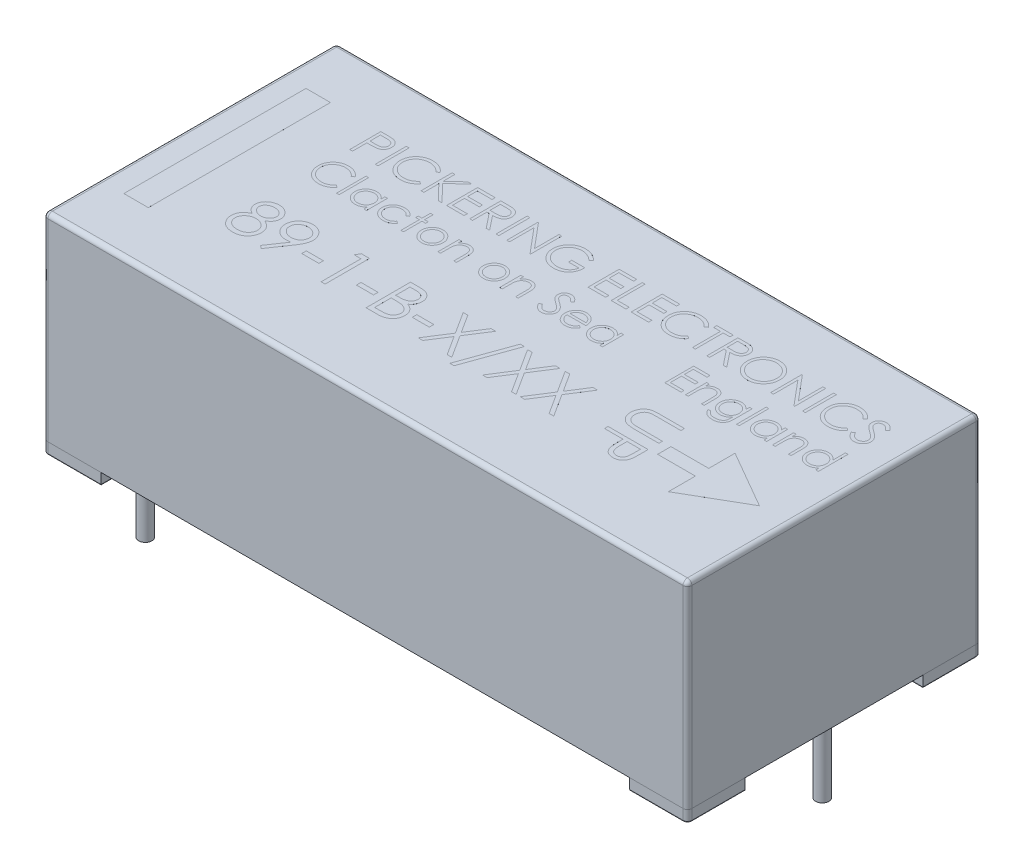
SolidWorks part; units mm, degrees
ref_plane "Front Plane" through (0, 0, 0) normal (0, 0, 1) x (1, 0, 0)
ref_plane "Top Plane" through (0, 0, 0) normal (0, 1, 0) x (1, 0, 0)
ref_plane "Right Plane" through (0, 0, 0) normal (1, 0, 0) x (0, 0, -1)
sketch "Sketch2" plane through (0, 0, 0) normal (0, 1, 0) x (1, 0, 0)
  line L1 (14.5, -6.6) -> (-14.5, -6.6)
  line L2 (14.5, -6.6) -> (14.5, 6.6)
  line L3 (14.5, 6.6) -> (-14.5, 6.6)
  line L4 (-14.5, -6.6) -> (-14.5, 6.6)
  line L5 (14.5, -6.6) -> (-14.5, 6.6) construction
  line L6 (14.5, 6.6) -> (-14.5, -6.6) construction
  point P0 (0, 0)
  dimension "D1" = 13.2
  dimension "D2" = 29
extrude "Main Body" add sketch "Sketch2" along normal blind 8.89 draft 0.023
sketch "Sketch9" plane through (0, 0, 0) normal (0, -1, 0) x (1, 0, 0)
  line L0 (-14.5, -6.6) -> (-14.5, 6.6) construction
  circle A0 centre (-12.7, -3.81) radius 0.3
  circle A2 centre (-12.7, -1.27) radius 0.3
  circle A3 centre (-12.7, 3.81) radius 0.3
  dimension "D1" = 0.6
  dimension "D5" = 0.6
  dimension "D7" = 0.6
  dimension "D2" = 2.54
  dimension "D3" = 1.8
  dimension "D4" = 5.08
extrude "Left hand Pins" add sketch "Sketch9" along normal blind 4.31
sketch "Sketch10" plane through (0, 0, 0) normal (0, -1, 0) x (1, 0, 0)
  line L1 (14.5, 6.6) -> (11.9, 6.6)
  line L2 (14.5, 6.6) -> (14.5, 4)
  line L3 (14.5, 4) -> (11.9, 4)
  line L4 (11.9, 6.6) -> (11.9, 4)
  dimension "D1" = 2.6
  dimension "D2" = 2.6
extrude "Foot" add sketch "Sketch10" along normal blind 0.51
sketch "Sketch11" plane through (0, -0.51, 0) normal (0, -1, 0) x (1, 0, 0)
  line L0 (14.5, 6.6) -> (11.9, 6.6) construction
  line L1 (11.9, 4) -> (13.95, 4)
  line L2 (11.9, 4) -> (11.9, 6.05)
  line L3 (11.9, 6.05) -> (13.95, 6.05)
  line L4 (13.95, 4) -> (13.95, 6.05)
  line L5 (14.5, 4) -> (14.5, 6.6) construction
  dimension "D1" = 0.55
  dimension "D2" = 0.55
extrude "foot cut" cut sketch "Sketch11" against normal up to surface (0.51 mm away)
mirror "Mirror3" about plane through (0, 0, 0) normal (0, 0, 1) of "foot cut", "Foot"
mirror "Mirror4" about plane through (0, 0, 0) normal (1, 0, 0) of "Mirror3", "Foot", "foot cut"
sketch "Sketch12"
  dimension "D1" = 1.1
  dimension "D2" = 8.2
  dimension "D3" = 2.4965
  dimension "D4" = 1.4
  dimension "D5" = 2
  dimension "D6" = 3.8
extrude "Lettering" add sketch "Sketch12" along normal blind 0.0001
sketch "Sketch13" plane through (0, 0, 0) normal (0, -1, 0) x (1, 0, 0)
  line L1 (11.9, -6.6) -> (-11.9, -6.6) construction
  line L3 (14.5, 4) -> (14.5, -4) construction
  circle A0 centre (12.7, -1.27) radius 0.3
  dimension "D1" = 0.6
  dimension "D2" = 5.33
  dimension "D5" = 1.8
extrude "Right hand pins" add sketch "Sketch13" along normal blind 4.31
fillet "Fillet1" radius 0.2 12 edges at (14.5, -0.255, -6.6) (14.5, -0.255, 6.6) (-14.5, -0.255, 6.6) (-14.5, -0.255, -6.6) (14.4983, 4.445, -6.5983) (0, 8.89, -6.5965) (14.4983, 4.445, 6.5983) (14.4965, 8.89, 0) (-14.4983, 4.445, 6.5983) (-14.4983, 4.445, -6.5983) (-14.4965, 8.89, 0) (0, 8.89, 6.5965)
fillet "Fillet2" radius 0.05 28 edges at (-14.4414, -0.51, -6.5414) (-13.1, -0.51, -6.6) (-11.9, -0.51, -6.325) (-12.925, -0.51, -6.05) (-13.95, -0.51, -5.025) (-14.225, -0.51, -4) (-14.5, -0.51, -5.2) (14.4414, -0.51, 6.5414) (14.4414, -0.51, -6.5414) (-14.4414, -0.51, 6.5414) (13.1, -0.51, 6.6) (11.9, -0.51, 6.325) (12.925, -0.51, 6.05) (13.95, -0.51, 5.025) (14.225, -0.51, 4) (14.5, -0.51, 5.2) (14.5, -0.51, -5.2) (14.225, -0.51, -4) (13.95, -0.51, -5.025) (12.925, -0.51, -6.05) (11.9, -0.51, -6.325) (13.1, -0.51, -6.6) (-14.5, -0.51, 5.2) (-14.225, -0.51, 4) (-13.95, -0.51, 5.025) (-12.925, -0.51, 6.05) (-11.9, -0.51, 6.325) (-13.1, -0.51, 6.6)
sketch "Sketch14"
sketch_block_instance "UP-1"
sketch_block "UP"
sketch_block_instance "Block1-1"
sketch_block "Block1" parameters "D1"=1.7, "D2"=2.2, "D3"=2.6, "D4"=1.24
extrude "Arrow" add sketch "Sketch14" along normal blind 0.0001
